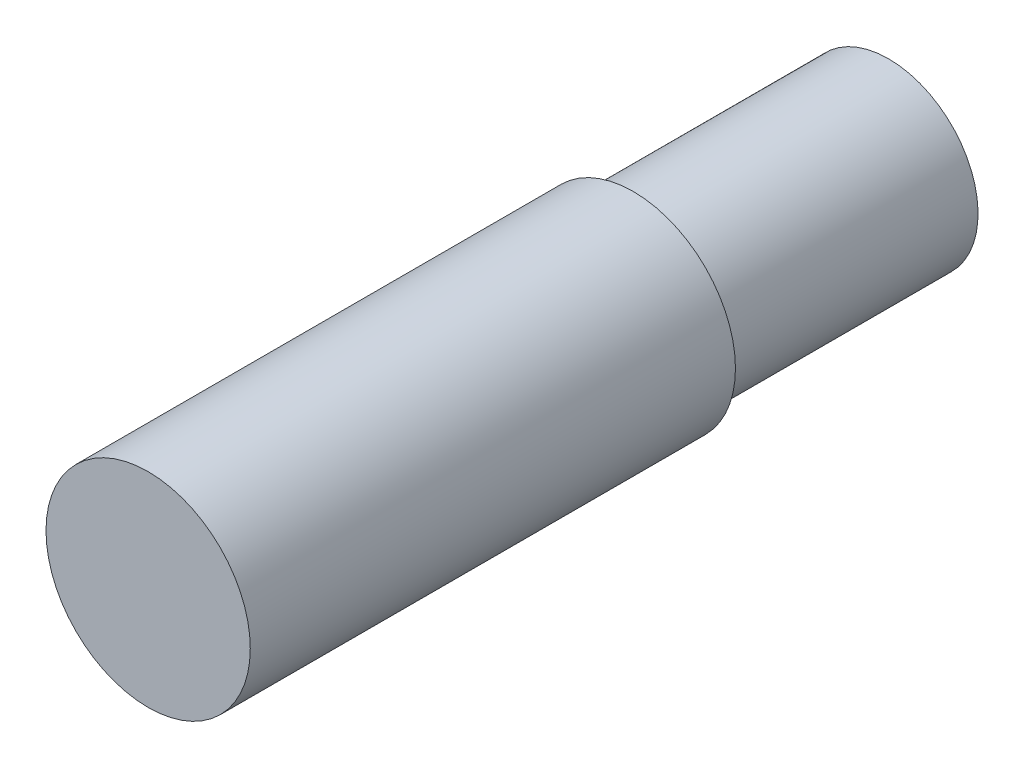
SolidWorks part; units mm, degrees
ref_plane "Front XY" through (0, 0, 0) normal (0, 0, 1) x (1, 0, 0)
ref_plane "Top XZ" through (0, 0, 0) normal (0, 1, 0) x (1, 0, 0)
ref_plane "Right YZ" through (0, 0, 0) normal (1, 0, 0) x (0, 0, -1)
sketch "Sketch1" plane through (0, 0, 0) normal (1, 0, 0) x (0, 0, -1)
  line L0 (0, 0) -> (0, 25.4)
  line L1 (0, 25.4) -> (120.65, 25.4)
  line L2 (120.65, 25.4) -> (120.65, 22.225)
  line L3 (120.65, 22.225) -> (184.15, 22.225)
  line L4 (184.15, 22.225) -> (184.15, 0)
  line L5 (184.15, 0) -> (0, 0) construction
  line L6 (0, 0) -> (184.15, 0)
  dimension "D1" = 120.65
  dimension "D2" = 184.15
  dimension "D3" = 50.8
  dimension "D4" = 44.45
revolve "Revolve1" add sketch "Sketch1" angle 360 about L5
sketch "Sketch2" plane through (0, 0, 0) normal (1, 0, 0) x (0, 0, -1)
  line L0 (184.15, 0) -> (188.8998, 0)
  line L1 (184.15, -22.225) -> (184.15, 22.225) construction
  line L2 (184.15, 0) -> (184.15, 22.225)
  arc A0 (188.8998, 0) -> (184.15, 22.225) centre (134.5279, 0) ccw
  dimension "D1" = 4.7498
revolve "Revolve2" add sketch "Sketch2" angle 360 about L0
